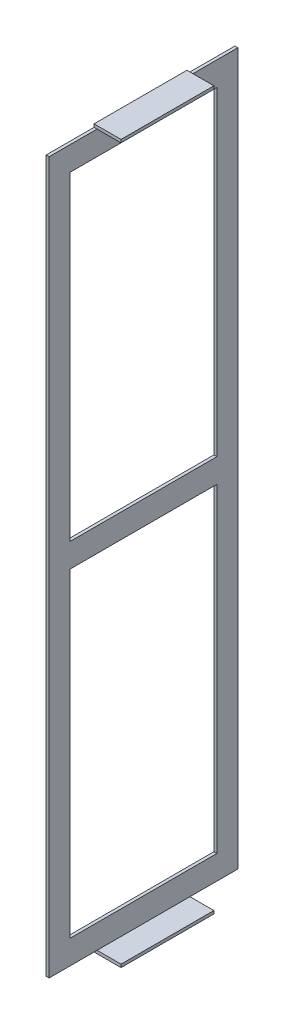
SolidWorks part; units mm, degrees
ref_plane "Front Plane" through (0, 0, 0) normal (0, 0, 1) x (1, 0, 0)
ref_plane "Top Plane" through (0, 0, 0) normal (0, 1, 0) x (1, 0, 0)
ref_plane "Right Plane" through (0, 0, 0) normal (1, 0, 0) x (0, 0, -1)
sketch "Sketch1" plane through (0, 0, 0) normal (0, 1, 0) x (1, 0, 0)
  line L0 (0, 50) -> (0, 41.5) construction
  line L1 (-50, 0) -> (-41.5, 0) construction
  line L2 (-50, 0) -> (-50, 50) construction
  line L3 (-50, 50) -> (50, 50) construction
  line L4 (50, 50) -> (50, -50) construction
  line L5 (50, -50) -> (-50, -50) construction
  line L6 (-50, -50) -> (-50, 0) construction
  line L7 (-41.5, 50) -> (-41.5, -50) construction
  line L8 (41.5, 50) -> (41.5, -50) construction
  line L9 (-50, 41.5) -> (50, 41.5) construction
  line L10 (-50, -41.5) -> (50, -41.5) construction
  line L11 (51.5875, 51.5875) -> (-51.5875, 51.5875)
  line L12 (50, 50) -> (-50, 50)
  line L13 (50, 50) -> (50, -50)
  line L14 (50, -50) -> (-50, -50)
  line L15 (-50, 50) -> (-50, -50)
  line L16 (-51.5875, 51.5875) -> (-51.5875, -51.5875)
  line L17 (51.5875, -51.5875) -> (-51.5875, -51.5875)
  line L18 (51.5875, 51.5875) -> (51.5875, -51.5875)
  line L47 (41.5, 0) -> (50, 0) construction
  line L52 (0, -41.5) -> (0, -50) construction
  circle A0 centre (0, 0) radius 76.2 construction
  dimension "D4" = 152.4
  dimension "D1" = 1.5875
extrude "BulkShellExtrude" add sketch "Sketch1" along normal blind 376.8
sketch "AirframeReferenceBottom" plane through (0, 0, 0) normal (0, 1, 0) x (1, 0, 0)
  circle A0 centre (0, 0) radius 76.2 construction
  dimension "D1" = 152.4
sketch "AxialReference" plane through (0, 0, 0) normal (1, 0, 0) x (0, 0, -1)
  line L0 (0, 0) -> (0, 376.8) construction
  line L1 (-51.5875, 376.8) -> (51.5875, 376.8) construction
sketch "AirframeReferenceTop" plane through (0, 376.8, 0) normal (0, 1, 0) x (1, 0, 0)
  circle A0 centre (0, 0) radius 76.2 construction
  dimension "D1" = 152.4
sketch "Sketch14" plane through (51.5875, 0, 0) normal (1, 0, 0) x (0, 0, -1)
  line L0 (-51.5875, 376.8) -> (-51.5875, 0) construction
  line L1 (-38.8875, 364.1) -> (38.8875, 364.1)
  line L2 (-38.8875, 364.1) -> (-38.8875, 12.7)
  line L3 (-38.8875, 12.7) -> (38.8875, 12.7)
  line L4 (38.8875, 364.1) -> (38.8875, 12.7)
  line L5 (51.5875, 376.8) -> (51.5875, 0) construction
  line L6 (76.2, 376.8) -> (-76.2, 376.8) construction
  line L7 (76.2, 0) -> (-76.2, 0) construction
  dimension "D1" = 12.7
  dimension "D2" = 12.7
  dimension "D3" = 12.7
  dimension "D4" = 12.7
extrude "SideWallCut" cut sketch "Sketch14" against normal blind 103.1875
pattern_circular "SideWallCutPattern" count 4 over 360 about axis through (0, 0, 0) along (0, 1, 0) of "SideWallCut"
sketch "Sketch20" plane through (0, 0, 51.5875) normal (0, 0, 1) x (1, 0, 0)
  line L0 (-38.8875, 188.4) -> (38.8875, 188.4) construction
  line L1 (-38.8875, 364.1) -> (38.8875, 364.1) construction
  line L2 (-38.8875, 364.1) -> (-38.8875, 12.7) construction
  line L3 (-38.8875, 12.7) -> (38.8875, 12.7) construction
  line L4 (38.8875, 364.1) -> (38.8875, 12.7) construction
  line L5 (-38.8875, 182.05) -> (38.8875, 182.05)
  line L6 (-38.8875, 194.75) -> (38.8875, 194.75)
  line L8 (-38.8875, 194.75) -> (38.8875, 194.75)
  line L9 (-38.8875, 194.75) -> (-38.8875, 182.05)
  line L10 (-38.8875, 182.05) -> (38.8875, 182.05)
  line L11 (38.8875, 194.75) -> (38.8875, 182.05)
  dimension "D1" = 6.35
  dimension "D2" = 6.35
extrude "CenterSupport" add sketch "Sketch20" against normal blind 1.5875 contours L6 L5 M27 M29
pattern_circular "CenterSupportPatternCirc" count 4 over 360 about axis through (0, 0, 0) along (0, 1, 0) of "CenterSupport"
sketch "Sketch21" plane through (51.5875, 0, 0) normal (1, 0, 0) x (0, 0, -1)
  line L1 (-51.5875, 376.8) -> (-50, 376.8)
  line L2 (-51.5875, 376.8) -> (-51.5875, 0)
  line L3 (-51.5875, 0) -> (-50, 0)
  line L4 (-50, 376.8) -> (-50, 0)
  line L5 (51.5875, 0) -> (50, 0)
  line L6 (51.5875, 0) -> (51.5875, 376.8)
  line L7 (51.5875, 376.8) -> (50, 376.8)
  line L8 (50, 0) -> (50, 376.8)
extrude "Cut-Extrude2" cut sketch "Sketch21" against normal blind 103.1875
sketch "Sketch22" plane through (0, 376.8, 0) normal (0, 1, 0) x (1, 0, 0)
  line L0 (50, -50) -> (50, 50) construction
  line L1 (50, 24.6) -> (51.5875, 24.6)
  line L2 (50, 24.6) -> (50, -24.6)
  line L3 (50, -24.6) -> (51.5875, -24.6)
  line L4 (51.5875, 24.6) -> (51.5875, -24.6)
  line L5 (51.5875, -50) -> (51.5875, 50) construction
  line L6 (50, 50) -> (51.5875, 50) construction
  line L7 (50, -50) -> (51.5875, -50) construction
  dimension "D1" = 25.4
  dimension "D2" = 25.4
extrude "Boss-Extrude1" add sketch "Sketch22" along normal blind 1.5875
sketch "Sketch23" plane through (51.5875, 0, 0) normal (1, 0, 0) x (0, 0, -1)
  line L1 (-24.6, 378.3875) -> (24.6, 378.3875)
  line L2 (-24.6, 378.3875) -> (-24.6, 376.8)
  line L3 (-24.6, 376.8) -> (24.6, 376.8)
  line L4 (24.6, 378.3875) -> (24.6, 376.8)
extrude "Boss-Extrude2" add sketch "Sketch23" along normal blind 12.7
ref_plane "Plane1" through (0, 188.4, 0) normal (0, 1, 0) x (1, 0, 0)
mirror "Mirror1" about plane through (0, 188.4, 0) normal (0, 1, 0) of "Boss-Extrude1", "Boss-Extrude2"
